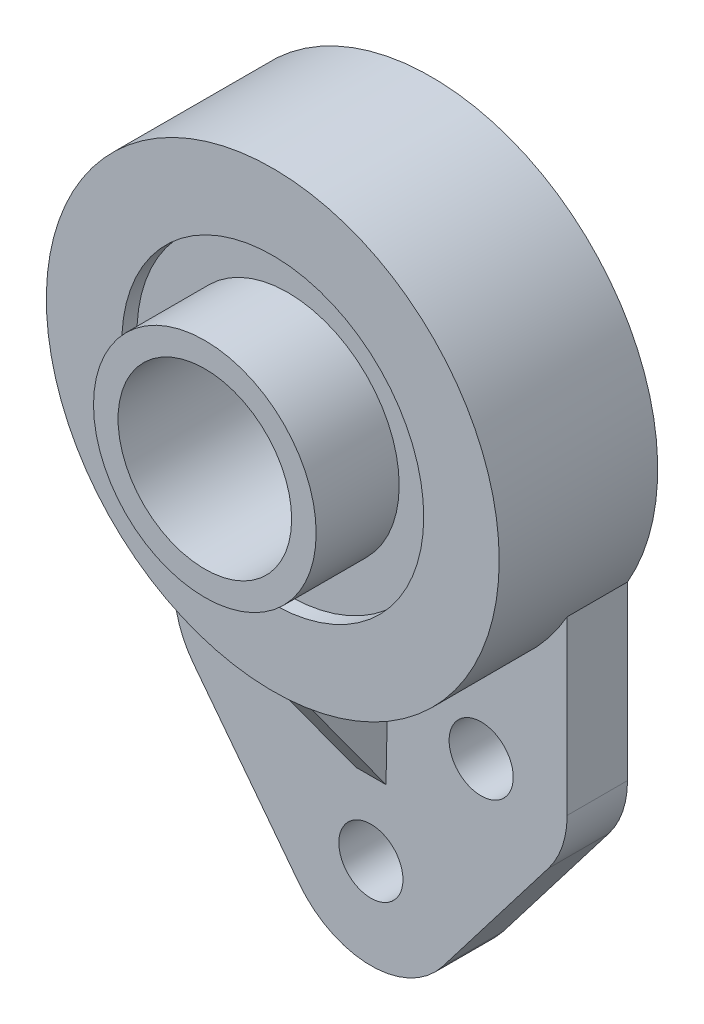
SolidWorks part; units mm, degrees
ref_plane "Plane1" through (0, 0, 0) normal (0, 0, 1) x (1, 0, 0)
ref_plane "Plane2" through (0, 0, 0) normal (0, 1, 0) x (1, 0, 0)
ref_plane "Plane3" through (0, 0, 0) normal (1, 0, 0) x (0, 0, -1)
sketch "Sketch1" plane through (0, 0, 0) normal (0, 0, 1) x (1, 0, 0)
  line L0 (0, 0) -> (0, -130.829) construction
  line L1 (15.1134, -100.4969) -> (37.3384, -71.5327)
  line L2 (41.275, -59.9358) -> (41.275, -23.7595)
  line L3 (-41.275, -59.9358) -> (-41.275, -23.7595)
  line L4 (-15.1134, -100.4969) -> (-37.3384, -71.5327)
  arc A0 (41.275, -23.7595) -> (-41.275, -23.7595) centre (0, 0) ccw
  arc A1 (-15.1134, -100.4969) -> (15.1134, -100.4969) centre (0, -88.9) ccw
  arc A2 (37.3384, -71.5327) -> (41.275, -59.9358) centre (22.225, -59.9358) ccw
  arc A3 (-37.3384, -71.5327) -> (-41.275, -59.9358) centre (-22.225, -59.9358) cw
  dimension "D1" = 95.25
  dimension "D5" = 19.05
  dimension "D2" = 37.5
  dimension "D3" = 82.55
  dimension "D4" = 155.575
extrude "Base-Extrude" add sketch "Sketch1" along normal blind 12.7
sketch "Sketch2" plane through (0, 0, 0) normal (0, 0, 1) x (1, 0, 0)
  circle A0 centre (0, 0) radius 47.625
  arc A1 (41.275, -23.7595) -> (-41.275, -23.7595) centre (0, 0) ccw construction
extrude "Boss-Extrude1" add sketch "Sketch2" along normal blind 33.3375
sketch "Sketch3" plane through (0, 0, 12.7) normal (0, 0, 1) x (1, 0, 0)
  circle A0 centre (-22.225, -59.9358) radius 6.7437
  circle A1 centre (0, -88.9) radius 6.7437
  circle A2 centre (22.225, -59.9358) radius 6.7437
  dimension "D1" = 13.4874
extrude "Cut-Extrude1" cut sketch "Sketch3" against normal through all
fillet "Fillet3" radius 3.175
sketch "Sketch4" plane through (0, 0, 0) normal (1, 0, 0) x (0, 0, -1)
  line L0 (-31.3843, -47.6721) -> (-12.7, -73.3778)
  line L1 (-12.7, -100.4969) -> (-12.7, -71.5327) construction
rib "Rib1" sketch "Sketch4" sketch "Sketch4" thickness 6.35 extrusion direction parallel to sketch draft on yes draft angle 2 parameters "D1"=6.35, "D3"=2
fillet "Fillet9" radius 1.524
fillet "Fillet10" radius 1.524
sketch "Sketch5" plane through (0, 0, 33.3375) normal (0, 0, 1) x (1, 0, 0)
  circle A0 centre (0, 0) radius 31.75
  dimension "D1" = 63.5
extrude "Cut-Extrude2" cut sketch "Sketch5" against normal blind 3.175
sketch "Sketch6" plane through (0, 0, 0) normal (0, 0, 1) x (1, 0, 0)
  circle A0 centre (0, 0) radius 23.4156
  dimension "D1" = 46.8312
extrude "Boss-Extrude2" add sketch "Sketch6" along normal blind 47.625
sketch "Sketch7" plane through (0, 0, 47.625) normal (0, 0, 1) x (1, 0, 0)
  circle A0 centre (0, 0) radius 18.2562
  dimension "D1" = 36.5125
extrude "Cut-Extrude3" cut sketch "Sketch7" against normal through all
fillet "Fillet11" radius 1.524
fillet "Fillet12" radius 3.048
sketch "Sketch8" plane through (0, 0, 12.7) normal (0, 0, 1) x (1, 0, 0)
  line L0 (-15.1134, -100.4969) -> (-37.3384, -71.5327) construction
  line L1 (15.1134, -100.4969) -> (37.3384, -71.5327) construction
  circle A0 centre (0, -88.9) radius 6.7437
  dimension "D1" = 13.4874
  dimension "D2" = 19.05
  dimension "D3" = 19.05
extrude "Cut-Extrude4" cut sketch "Sketch8" against normal through all
pattern_linear "LPattern1" count 2 spacing 38.1 along (-0.6088, 0.7934, 0) count 2 spacing 38.1 along (0.6088, 0.7934, 0) of "Cut-Extrude4"
